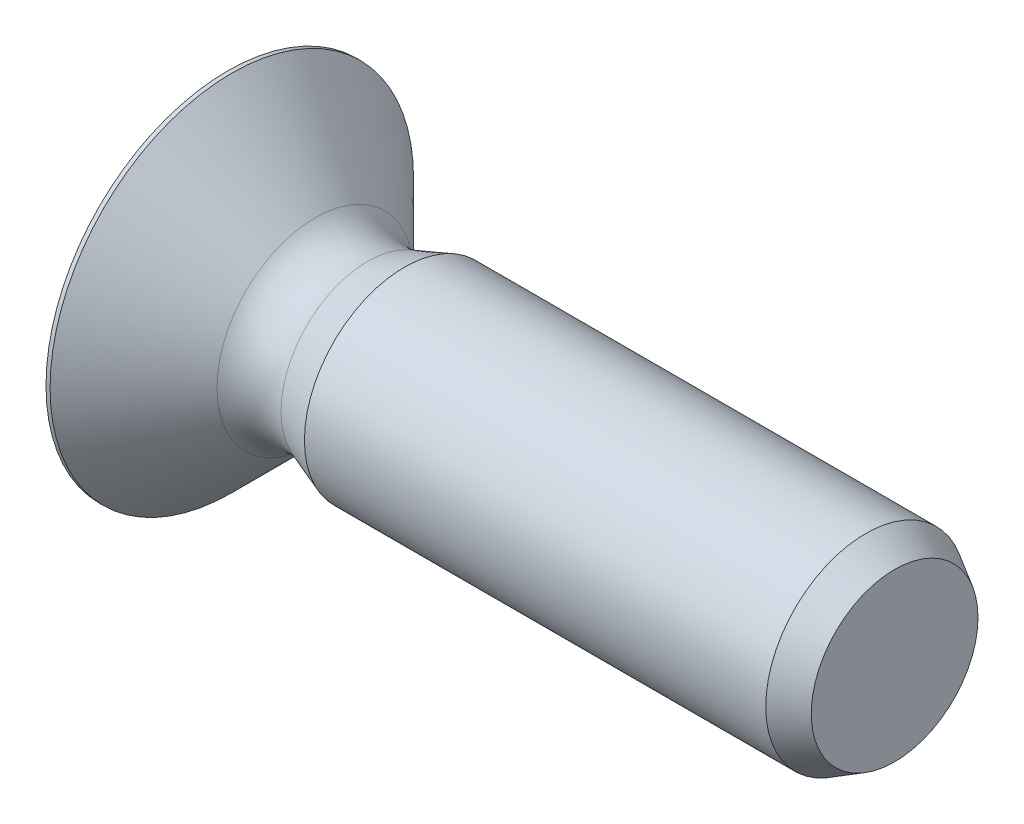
SolidWorks part; units mm, degrees
ref_plane "Front" through (0, 0, 0) normal (0, 0, 1) x (1, 0, 0)
ref_plane "Top" through (0, 0, 0) normal (0, 1, 0) x (1, 0, 0)
ref_plane "Right" through (0, 0, 0) normal (1, 0, 0) x (0, 0, -1)
sketch "Sketch1" plane through (0, 0, 0) normal (0, 0, 1) x (1, 0, 0)
  line L0 (-38.1054, 0) -> (11.3165, 0) construction
  line L1 (20, 0) -> (20, 3)
  line L2 (20, 3) -> (5.3, 3)
  line L3 (5.3, 3) -> (3.3, 2.2721)
  line L4 (3.3, 2.2721) -> (0.1221, 5.45)
  line L5 (20, 0) -> (0, 0)
  line L6 (0.1221, 5.45) -> (0, 5.45)
  line L7 (0, 5.45) -> (0, 0)
  dimension "D2" = 20
  dimension "D1" = 45
  dimension "d" = 6
  dimension "k" = 3.3
  dimension "l" = 20
  dimension "dk" = 10.9
  dimension "a" = 2
revolve "Base" add sketch "Sketch1" angle 360 about L0
sketch "Sketch2" plane through (0, 0, 0) normal (0, 1, 0) x (1, 0, 0)
  line L0 (21.3282, 0) -> (6.3612, 0) construction
  line L2 (19.134, -3) -> (20, -2.5)
  line L6 (20, -2.5) -> (20, -3)
  line L7 (20, -3) -> (19.134, -3)
  dimension "D1" = 30
  dimension "D2" = 5
  dimension "D3" = 6
revolve "BaseEnd" cut sketch "Sketch2" angle 360 about L0
sketch "Sketch3" plane through (0, 0, 0) normal (1, 0, 0) x (0, 0, -1)
  line L0 (0, 0) -> (-3.9695, 0) construction
  line L1 (0, 0) -> (0, 3.5828) construction
  line L2 (0.73, 3.65) -> (-0.73, 3.65)
  line L3 (-0.73, 3.65) -> (-0.73, 0.73)
  line L4 (-0.73, 0.73) -> (-3.65, 0.73)
  line L5 (-3.65, 0.73) -> (-3.65, -0.73)
  line L6 (-0.73, -0.73) -> (-3.65, -0.73)
  line L7 (-0.73, -3.65) -> (-0.73, -0.73)
  line L8 (0.73, -3.65) -> (-0.73, -3.65)
  line L9 (0.73, -3.65) -> (0.73, -0.73)
  line L10 (0.73, -0.73) -> (3.65, -0.73)
  line L11 (3.65, 0.73) -> (3.65, -0.73)
  line L12 (0.73, 0.73) -> (3.65, 0.73)
  line L13 (0.73, 3.65) -> (0.73, 0.73)
  point P4 (3.65, 0)
  point P10 (-3.65, 0)
  point P14 (0, -3.65)
  point P19 (0, 3.65)
  dimension "m" = 7.3
  dimension "D2" = 1.46
extrude "CrossRecess" cut sketch "Sketch3" along normal blind 1.65
draft "Draft1" type of draft neutral plane draft angle 45 faces to draft 4 parameters "D1"=45
fillet "Fillet1" radius 1.5 1 edges at (3.3, 0, 2.2721)
sketch "Sketch5" plane through (0, 0, 0) normal (0, 0, 1) x (1, 0, 0)
  line L0 (19.1269, 3.0141) -> (19.141, 3.0141)
  line L1 (19.141, 3.0141) -> (19.141, 3)
  line L2 (19.141, 3) -> (19.134, 2.9878)
  line L3 (19.134, 2.9878) -> (19.1269, 3)
  line L4 (19.1269, 3) -> (19.1269, 3.0141)
  line L5 (0, 0) -> (20.5492, 0) construction
  line L6 (0, 5.45) -> (0, -5.45) construction
  line L7 (19.134, 3) -> (19.134, -3) construction
  dimension "D1" = 6
  dimension "D2" = 2.9878
revolve "Cut-Revolve10" [suppressed] cut sketch "Sketch5" angle 360 about L5
pattern_linear "LPattern10" [suppressed] count 862 spacing 0.0171 along (1, 0, 0)
sketch "Sketch4" plane through (0, 0, 0) normal (0, 0, 1) x (1, 0, 0)
  line L0 (14.0155, 0) -> (-1.5304, 0) construction
  line L1 (2.6243, 2.9478) -> (0.1221, 5.45) construction
  line L2 (3.3125, 2.9878) -> (8.8873, 2.9878)
  line L3 (8.8873, 2.9878) -> (10.1774, 3)
  line L4 (2.5721, 3) -> (3.2875, 2.988)
  line L5 (10.1774, 3) -> (2.5721, 3)
  line L7 (20, -2.5) -> (20, 2.5) construction
  arc A0 (3.3125, 2.9878) -> (3.2875, 2.988) centre (3.3125, 4.4878) cw
  point P14 (3.3, 2.9878)
  dimension "D3" = 1.5
  dimension "D1" = 2.9878
  dimension "D2" = 16.7
  dimension "b" = 9.8226
  dimension "D4" = 6
  dimension "x" = 1.2901
revolve "Cut-Revolve2" [suppressed] cut sketch "Sketch4" angle 360 about L0
equation "\"D2@ThreadCosmetic1\" = \"d@Sketch1\" - 1"
equation "\"D2@Sketch2\" = \"D2@ThreadCosmetic1\""
equation "\"D3@Sketch2\" = \"d@Sketch1\""
equation "\"D2@Sketch3\" = \"m@Sketch3\" / 5"
equation "\"D1@Sketch4\" = \"d@Sketch1\" / 2 - \"a@Sketch1\" * tan ( 3.14 / 9 ) "
equation "\"D1@CrossRecess\" = \"k@Sketch1\" /2"
equation "\"D2@Sketch4\" = \"l@Sketch1\" - \"k@Sketch1\""
equation "\"D3@Sketch4\" = \"r@Fillet1\""
equation "\"D4@Sketch4\" = \"d@Sketch1\""
equation "\"D1@Sketch5\" = \"d@Sketch1\""
equation "\"D2@Sketch5\" = \"d@Sketch1\" / 2 - \"a@Sketch1\" * tan ( 3.14 / 9 ) "
equation "\"D3@LPattern10\" = (  \"D1@Sketch5\" / 2 - \"D2@Sketch5\" )  * 1.4"
equation "\"D1@LPattern10\" = (  \"l@Sketch1\" - \"k@Sketch1\" - \"a@Sketch1\" )  / \"D3@LPattern10\""
